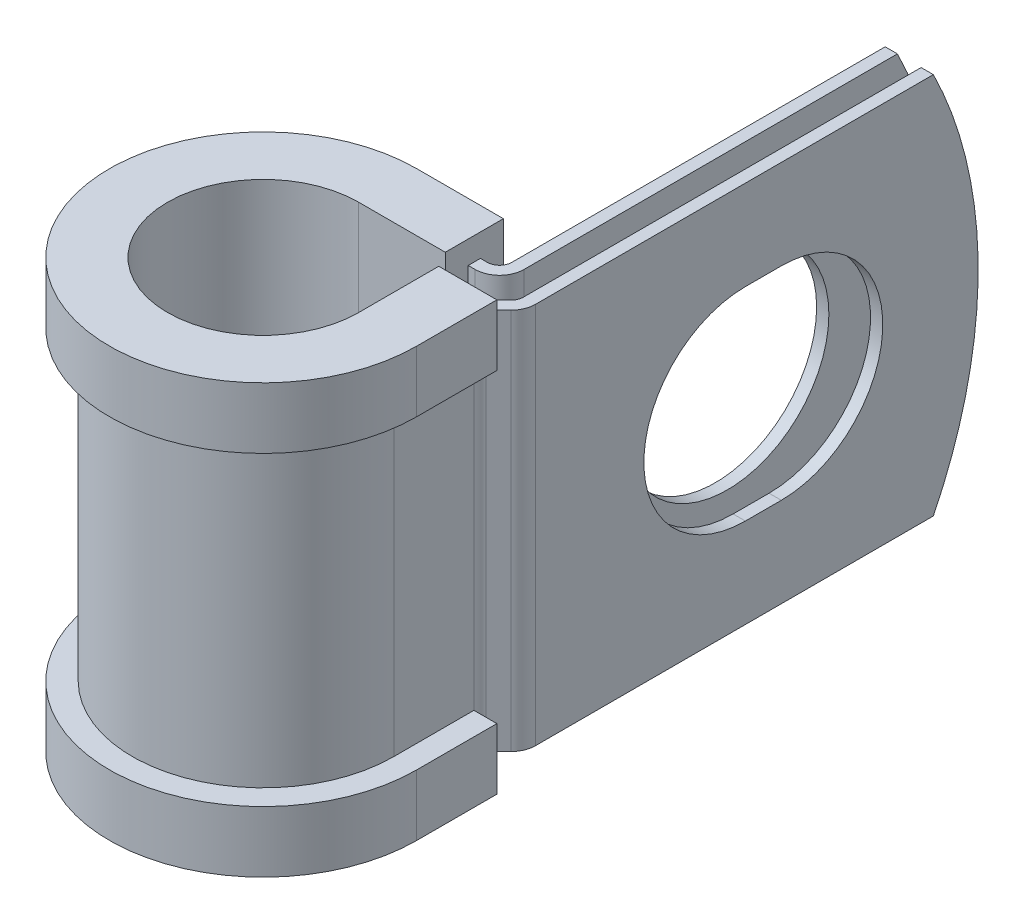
SolidWorks part; units mm, degrees
ref_plane "Front Plane" through (0, 0, 0) normal (0, 0, 1) x (1, 0, 0)
ref_plane "Top Plane" through (0, 0, 0) normal (0, 1, 0) x (1, 0, 0)
ref_plane "Right Plane" through (0, 0, 0) normal (1, 0, 0) x (0, 0, -1)
sketch "Sketch1" plane through (0, 0, 0) normal (0, 1, 0) x (1, 0, 0)
  line L0 (0, 7.874) -> (6.214, 7.874)
  line L1 (7.874, 0) -> (7.874, 5.3236)
  line L2 (7.8396, 37.2872) -> (7.8396, 9.4996)
  line L3 (8.3501, 6.4731) -> (9.1763, 7.2993)
  line L5 (9.4144, 7.874) -> (9.4144, 37.2872)
  arc A0 (0, 7.874) -> (7.874, 0) centre (0, 0) ccw
  arc A1 (8.3501, 6.4731) -> (7.874, 5.3236) centre (9.4996, 5.3236) ccw
  arc A2 (9.1763, 7.2993) -> (9.4144, 7.874) centre (8.6016, 7.874) ccw
  arc A3 (6.214, 7.874) -> (7.8396, 9.4996) centre (6.214, 9.4996) ccw
extrude "Extrude-Thin1" add sketch "Sketch1" along normal mid plane 25.4 thin
sketch "Sketch2" plane through (7.0268, 0, 0) normal (-1, 0, 0) x (0, 0, 1)
  line L0 (-37.2872, 12.7) -> (-37.2872, -12.7) construction
  line L1 (0, 12.7) -> (0, -12.7) construction
  circle A0 centre (-23.0124, 0) radius 6.7437
  point P2 (-37.2872, 0)
extrude "Cut-Extrude1" cut sketch "Sketch2" against normal up to surface (0.8128 mm away)
sketch "Sketch3" plane through (10.2272, 0, 0) normal (1, 0, 0) x (0, 0, -1)
  line L0 (21.8186, 0) -> (24.2062, 0) construction
  line L1 (21.8186, 6.7437) -> (24.2062, 6.7437)
  line L2 (21.8186, -6.7437) -> (24.2062, -6.7437)
  line L3 (37.2872, 12.7) -> (37.2872, -12.7) construction
  arc A0 (21.8186, 6.7437) -> (21.8186, -6.7437) centre (21.8186, 0) ccw
  arc A1 (24.2062, -6.7437) -> (24.2062, 6.7437) centre (24.2062, 0) ccw
  point P3 (23.0124, 0)
  point P8 (37.2872, 0)
  point P11 (15.0749, 0)
  point P12 (30.9499, 0)
extrude "Cut-Extrude2" cut sketch "Sketch3" against normal up to surface (0.8128 mm away)
sketch "Sketch4" plane through (7.0268, 0, 0) normal (-1, 0, 0) x (0, 0, 1)
  line L0 (-37.2872, 12.7) -> (-37.2872, -12.7)
  line L1 (-37.2872, 12.7) -> (-34.3099, 12.7)
  line L2 (-37.2872, 12.7) -> (-9.4996, 12.7) construction
  line L3 (-37.2872, -12.7) -> (-34.3099, -12.7)
  line L4 (-37.2872, -12.7) -> (-9.4996, -12.7) construction
  arc A0 (-34.3099, 12.7) -> (-34.3099, -12.7) centre (-8.7122, 0) ccw
extrude "Cut-Extrude3" cut sketch "Sketch4" against normal through all contours A0 M4 M5 | A0 L0 M2
ref_plane "Plane1" through (0, 0, -5.3236) normal (0, 0, -1) x (-1, 0, 0)
ref_plane "Plane2" through (5.7568, 0, 0) normal (-1, 0, 0) x (0, 0, 1)
sketch "Sketch5" plane through (0, 0, -5.3236) normal (0, 0, -1) x (-1, 0, 0)
  line L0 (-8.6868, 12.7) -> (-7.874, 12.7)
  line L1 (-8.6868, 12.7) -> (-8.6868, -12.7) construction
  line L3 (-7.874, 12.7) -> (-7.874, -12.7)
  line L4 (-7.874, -12.7) -> (-8.6868, -12.7)
  line L5 (-8.6868, -12.7) -> (-8.6868, -10.16)
  line L6 (-8.6868, 12.7) -> (-8.6868, 10.16)
  line L7 (-10.2108, 14.224) -> (-10.2108, 10.16)
  line L8 (-10.2108, 14.224) -> (-6.35, 14.224)
  line L9 (-6.35, 14.224) -> (-6.35, -14.224)
  line L10 (-6.35, -14.224) -> (-10.2108, -14.224)
  line L11 (-10.2108, -14.224) -> (-10.2108, -10.16)
  line L12 (-10.2108, 10.16) -> (-8.6868, 10.16)
  line L13 (-8.6868, -10.16) -> (-10.2108, -10.16)
sketch "Sketch6" plane through (0, 12.7, 0) normal (0, 1, 0) x (1, 0, 0)
  line L0 (6.35, 0) -> (6.35, 5.3236)
  line L1 (6.35, 5.3236) -> (10.2108, 5.3236) construction
  line L2 (5.7568, 6.9878) -> (5.7568, -6.9878) construction
  line L5 (0, 6.35) -> (5.7568, 6.35)
  arc A0 (0, 6.35) -> (6.35, 0) centre (0, 0) ccw
sweep "Sweep1" add profiles "Sketch5" path "Sketch6"
equation "\"D4@Sketch5\" = \"D1@Extrude-Thin1\""
equation "\"D5@Sketch5\" = \"D5@Extrude-Thin1\""
equation "\"D1@Sketch3\" = \"D2@Sketch2\""
equation "\"D7@Sketch1\" = \"D3@Sketch2\" + \"D1@Sketch3\""
equation "\"D1@Sketch1\" = \"D1@Sketch6\" + 2 * \"D3@Sketch5\""
equation "\"D1@Sketch4\" = ( \"D1@Extrude-Thin1\" + .125 ) * 2"
equation "\"D9@Sketch1\"= \"D5@Extrude-Thin1\""
equation "\"D8@Sketch1\"= 2 * \"D5@Extrude-Thin1\""
equation "\"D2@Sketch1\" = 2 * \"D5@Extrude-Thin1\""
equation "\"D2@Sketch3\" = \"D1@Sketch2\""
